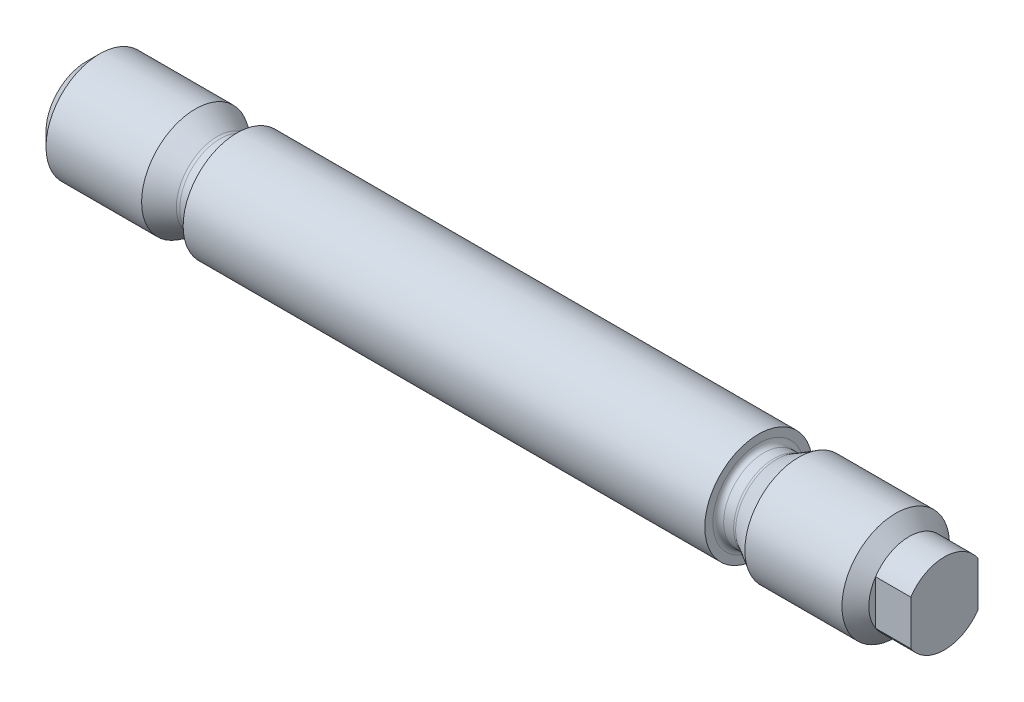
SolidWorks part; units mm, degrees
ref_plane "Plane1" through (0, 0, 0) normal (0, 0, 1) x (1, 0, 0)
ref_plane "Plane2" through (0, 0, 0) normal (0, 1, 0) x (1, 0, 0)
ref_plane "Plane3" through (0, 0, 0) normal (1, 0, 0) x (0, 0, -1)
sketch "BodySke" plane through (0, 0, 0) normal (0, 0, 1) x (1, 0, 0)
  line L0 (19.5, 6.1072) -> (16.2215, 8)
  line L1 (16.2215, 8) -> (2, 8)
  line L2 (22.4, 8) -> (22.4, 6.8)
  line L3 (21.6, 6) -> (19.9, 6)
  line L5 (2, 8) -> (0, 6)
  line L7 (100, 8) -> (100, 6.8)
  line L8 (100.8, 6) -> (102.2856, 6)
  line L9 (102.6856, 6.1072) -> (105.9641, 8)
  line L10 (105.9641, 8) -> (120.4, 8)
  line L11 (120.4, 8) -> (122.4, 6)
  line L12 (122.4, 6) -> (122.4, 0)
  line L13 (122.4, 0) -> (0, 0)
  line L14 (-3.175, 0) -> (101.6, 0) construction
  line L15 (108.7794, -6) -> (122.4, -6) construction
  line L16 (100, -6) -> (102.5, -6) construction
  line L17 (37.0699, -8) -> (100, -8) construction
  line L18 (0, 6) -> (0, 0)
  line L19 (22.4, 8) -> (100, 8)
  line L20 (104.5, 10.8514) -> (104.5, -6.5014) construction
  line L21 (100, 10.2761) -> (100, -5.5735) construction
  arc A0 (19.9, 6) -> (19.5, 6.1072) centre (19.9, 6.8) cw
  arc A1 (22.4, 6.8) -> (21.6, 6) centre (21.6, 6.8) cw
  arc A2 (102.2856, 6) -> (102.6856, 6.1072) centre (102.2856, 6.8) ccw
  arc A3 (100, 6.8) -> (100.8, 6) centre (100.8, 6.8) ccw
  point P26 (102.5, 6)
  point P29 (100, 6)
  dimension "Length" = 100
  dimension "Thread_neck_width" = 2.5
  dimension "Shoulder_neck_width" = 2.5
  dimension "Advance" = 2
  dimension "Thread_nom" = 22.4
  dimension "Thread_lim" = 17.9
  dimension "Studend_length" = 22.4
  dimension "Thread_len" = 22.4
revolve "BaseBody" add sketch "BodySke" angle 360 about L14
sketch "ThdSchSke" plane through (0, 0, 0) normal (0, 0, 1) x (1, 0, 0)
  line L0 (104.5, -6) -> (103.0996, -8)
  line L1 (104.5, -6) -> (105.9004, -8)
  line L2 (105.9004, -8) -> (105.9004, -10)
  line L3 (-3.175, 0) -> (5.1513, 0) construction
  line L5 (105.9004, -10) -> (103.0996, -10)
  line L6 (103.0996, -10) -> (103.0996, -8)
  line L7 (122.4, -6) -> (122.4, 6) construction
  dimension "Thread_minor" = 12
  dimension "Diameter" = 16
  dimension "Start" = 17.9
  dimension "SideAngle" = 55
  dimension "VeeAngle" = 70
  dimension "Overcut" = 20
revolve "ThreadSchematic" [suppressed] cut sketch "ThdSchSke" angle 360 about L3
pattern_linear "ThdSchPat" [suppressed]
sketch "ThdSchSketStud" plane through (0, 0, 0) normal (0, 0, 1) x (1, 0, 0)
  line L0 (17.9, -6) -> (16.4996, -8)
  line L1 (17.9, -6) -> (19.3004, -8)
  line L2 (19.3004, -8) -> (19.3004, -10)
  line L3 (-3.175, 0) -> (5.1513, 0) construction
  line L5 (19.3004, -10) -> (16.4996, -10)
  line L6 (16.4996, -10) -> (16.4996, -8)
  line L7 (0, 6) -> (0, -6) construction
  dimension "Thread_minor" = 12
  dimension "Diameter" = 16
  dimension "SideAngle" = 55
  dimension "VeeAngle" = 70
  dimension "Overcut" = 20
  dimension "Start_" = 17.9
revolve "ThreadSchematicStud" [suppressed] cut sketch "ThdSchSketStud" angle 360 about L3
pattern_linear "ThdSchPatStud" [suppressed]
sketch "DogPointSke" plane through (122.4, 0, 0) normal (1, 0, 0) x (0, 0, -1)
  line L0 (-5, 3.3166) -> (-5, -3.3166)
  line L1 (5, 3.3166) -> (5, -3.3166)
  line L2 (0, -9.525) -> (0, 9.525) construction
  arc A0 (-5, -3.3166) -> (5, -3.3166) centre (0, 0) ccw
  arc A2 (5, 3.3166) -> (-5, 3.3166) centre (0, 0) ccw
  dimension "Point_Dia" = 12
  dimension "Dog_Width" = 10
extrude "DogPoint" add sketch "DogPointSke" along normal blind 5.24
equation "\"Thread_len@BodySke\" = \"Thread_nom@BodySke\""
equation "\"Studend_length@BodySke\" = \"Thread_len@BodySke\""
equation "\"Thread_minor@ThreadCosmetic\" = \"Minor_dia@BodySke\""
equation "\"Thrd_minor@ThreadCosmeticStud\" = \"Thread_minor@ThreadCosmetic\""
equation "\"Thread_minor@ThdSchSke\" = \"Minor_dia@BodySke\""
equation "\"Diameter@ThdSchSke\" = \"Thread_dia@BodySke\""
equation "\"Overcut@ThdSchSke\" = \"Thread_dia@BodySke\" * 1.25"
equation "\"Start@ThdSchSke\" = \"Thread_nom@BodySke\"  - \"Thread_neck_width@BodySke\" - \"Advance@BodySke\""
equation "\"Num_threads@ThdSchPat\" = int( \"Start@ThdSchSke\" / \"Advance@BodySke\" + 0.999 ) + 1"
equation "\"Advance@ThdSchPat\" = \"Start@ThdSchSke\" /  ( \"Num_threads@ThdSchPat\" - 1 ) 'relax it"
equation "'  \"Num_threads@ThdSchPat\" = \"Num_threads@ThdSchPat\" - sgn( \"Num_threads@ThdSchPat\" - 1 ) '---chamfered tips only---"
equation "\"Diameter@ThdSchSketStud\" = \"Diameter@ThdSchSke\""
equation "\"Thread_minor@ThdSchSketStud\" = \"Thread_minor@ThdSchSke\""
equation "\"Overcut@ThdSchSketStud\" = \"Overcut@ThdSchSke\""
equation "\"Start_@ThdSchSketStud\" = \"Studend_length@BodySke\" - \"Shoulder_neck_width@BodySke\" - \"Advance@BodySke\""
equation "\"Num_threads@ThdSchPatStud\" = int( \"Start_@ThdSchSketStud\"/ \"Advance@BodySke\" + 0.999 )  + 1"
equation "\"Advance@ThdSchPatStud\" = \"Start_@ThdSchSketStud\" /  ( \"Num_threads@ThdSchPatStud\" - 1 ) 'relax it"
